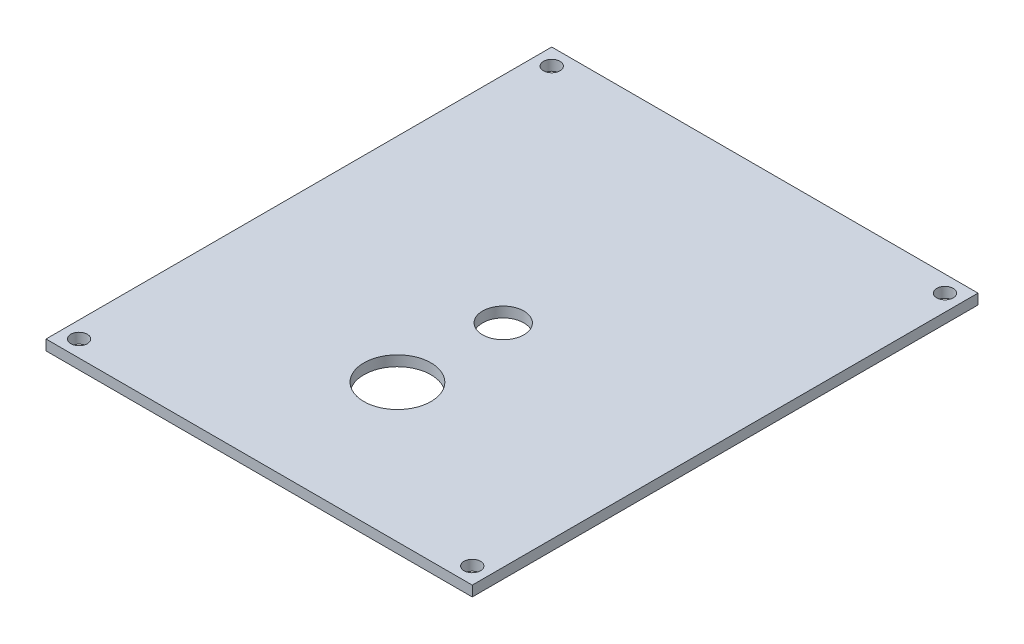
SolidWorks part; units mm, degrees
ref_plane "Front Plane" through (0, 0, 0) normal (0, 0, 1) x (1, 0, 0)
ref_plane "Top Plane" through (0, 0, 0) normal (0, 1, 0) x (1, 0, 0)
ref_plane "Right Plane" through (0, 0, 0) normal (1, 0, 0) x (0, 0, -1)
sketch "Sketch1" plane through (0, 0, 0) normal (0, 1, 0) x (1, 0, 0)
  line L1 (41.3, 49) -> (-41.3, 49)
  line L2 (41.3, 49) -> (41.3, -49)
  line L3 (41.3, -49) -> (-41.3, -49)
  line L4 (-41.3, 49) -> (-41.3, -49)
  line L5 (41.3, 49) -> (-41.3, -49) construction
  line L6 (41.3, -49) -> (-41.3, 49) construction
  point P0 (0, 0)
  dimension "D1" = 82.6
  dimension "D2" = 98
extrude "Boss-Extrude1" add sketch "Sketch1" along normal blind 2
hole_wizard "Ø3.2 (3.2) Diameter Hole1" positions "Sketch3" profile "Sketch2" hole size "Ø3.2" standard "ISO"
sketch "Sketch3" plane through (0, 2, 0) normal (0, 1, 0) x (1, 0, 0)
  line L0 (-41.3, 49) -> (-41.3, -49) construction
  line L1 (41.3, 49) -> (-41.3, 49) construction
  line L2 (41.3, -49) -> (41.3, 49) construction
  line L3 (-41.3, -49) -> (41.3, -49) construction
  point P0 (-38.1, 45.8)
  point P2 (38.1, 45.8)
  point P4 (38.1, -45.8)
  point P6 (-38.1, -45.8)
  dimension "D1" = 3.2
  dimension "D2" = 3.2
  dimension "D3" = 3.2
  dimension "D4" = 3.2
  dimension "D5" = 3.2
  dimension "D6" = 3.2
  dimension "D7" = 3.2
  dimension "D8" = 3.2
sketch "Sketch2" plane through (-38.1, 2, -45.8) normal (1, 0, 0) x (0, 0, 1)
  line L0 (0, 0) -> (0, 2)
  line L1 (0, 2) -> (1.6, 2)
  line L2 (1.6, 2) -> (1.6, 0)
  line L5 (1.6, 0) -> (0, 0)
  line L11 (0, -6.35) -> (0, 107.95) construction
  dimension "Thru Hole Dia." = 3.2
  dimension "Thru Hole Depth" = 2
sketch "Sketch4" plane through (0, 2, 0) normal (0, 1, 0) x (1, 0, 0)
  line L0 (-41.3, -49) -> (41.3, -49) construction
  circle A1 centre (0, -22.2) radius 6.5
  dimension "D2" = 13
  dimension "D3" = 26.8
extrude "Cut-Extrude1" cut sketch "Sketch4" against normal blind 2
sketch "Sketch5" plane through (0, 2, 0) normal (0, 1, 0) x (1, 0, 0)
  line L1 (-41.3, -49) -> (41.3, -49) construction
  line L2 (41.3, -49) -> (41.3, 49) construction
  circle A0 centre (0.3, -2) radius 4
  dimension "D1" = 8
  dimension "D2" = 47
  dimension "D3" = 41
extrude "Cut-Extrude2" cut sketch "Sketch5" against normal blind 10
